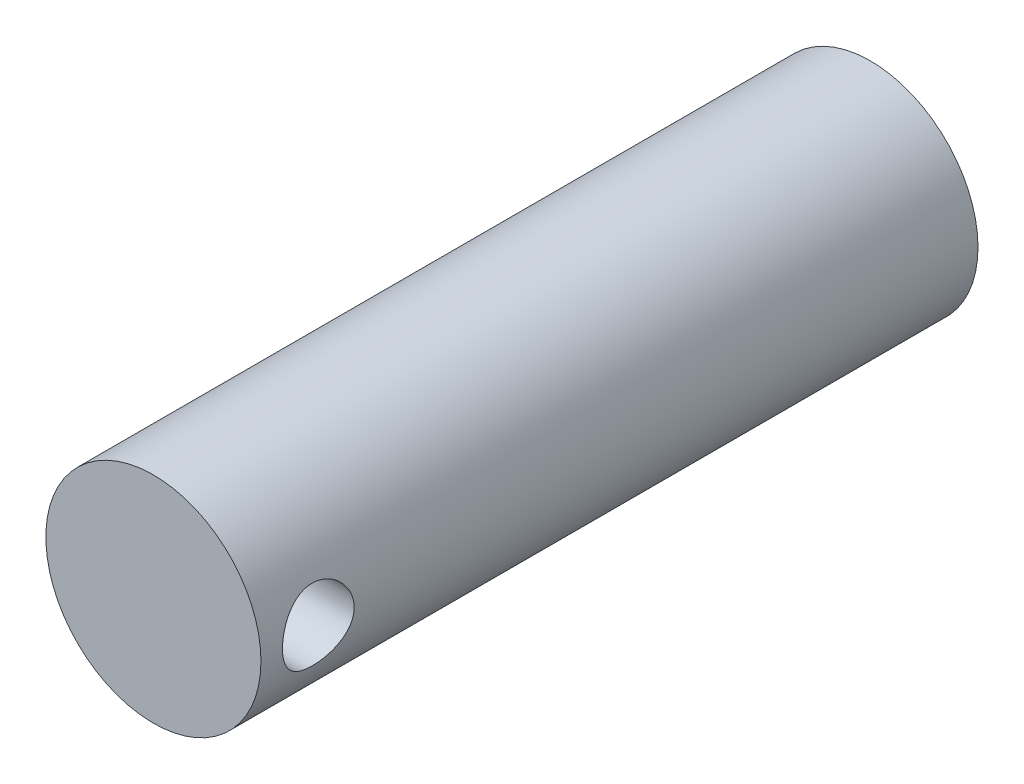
SolidWorks part; units mm, degrees
ref_plane "Front Plane" through (0, 0, 0) normal (0, 0, 1) x (1, 0, 0)
ref_plane "Top Plane" through (0, 0, 0) normal (0, 1, 0) x (1, 0, 0)
ref_plane "Right Plane" through (0, 0, 0) normal (1, 0, 0) x (0, 0, -1)
sketch "Sketch1" plane through (0, 0, 0) normal (0, 0, 1) x (1, 0, 0)
  circle A0 centre (0, 0) radius 7.5
  dimension "D1" = 15
extrude "Boss-Extrude1" add sketch "Sketch1" along normal blind 50
sketch "Sketch2" plane through (0, 0, 0) normal (1, 0, 0) x (0, 0, -1)
  line L0 (-50, 7.5) -> (-50, -7.5) construction
  circle A0 centre (-46, 0) radius 2.5
  dimension "D1" = 5
  dimension "D2" = 4
extrude "Cut-Extrude1" cut sketch "Sketch2" against normal mid plane 50 contours A0
